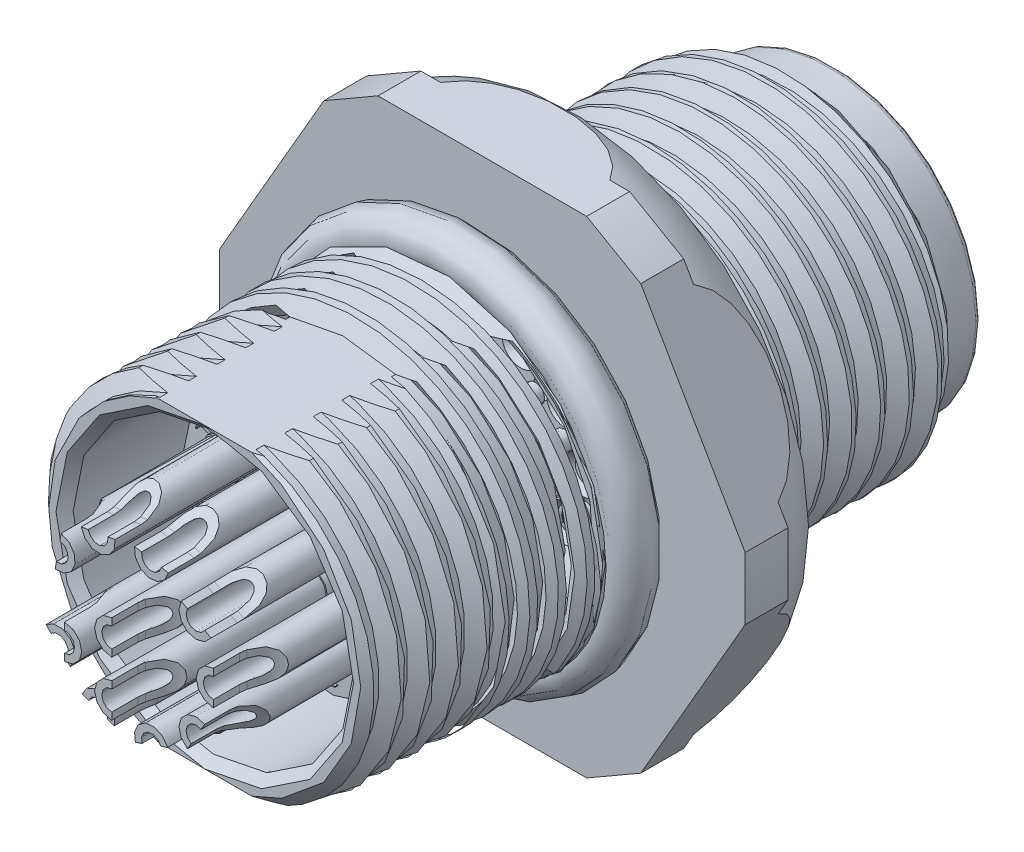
SolidWorks part; units mm, degrees
ref_plane "前视基准面" through (0, 0, 0) normal (0, 0, 1) x (1, 0, 0)
ref_plane "上视基准面" through (0, 0, 0) normal (0, 1, 0) x (1, 0, 0)
ref_plane "右视基准面" through (0, 0, 0) normal (1, 0, 0) x (0, 0, -1)
imported_body "FLQ-M12-M12(M12)-HB (1).stp"
other "删除面5"
sketch "草图2" plane through (0, 0, -0.2) normal (0, 0, 1) x (1, 0, 0)
  circle A1 centre (0, 0) radius 7
  circle A2 centre (0, 0) radius 5
  dimension "D1" = 14
  dimension "D2" = 10
extrude "凸台-拉伸1" add sketch "草图2" along normal blind 10
